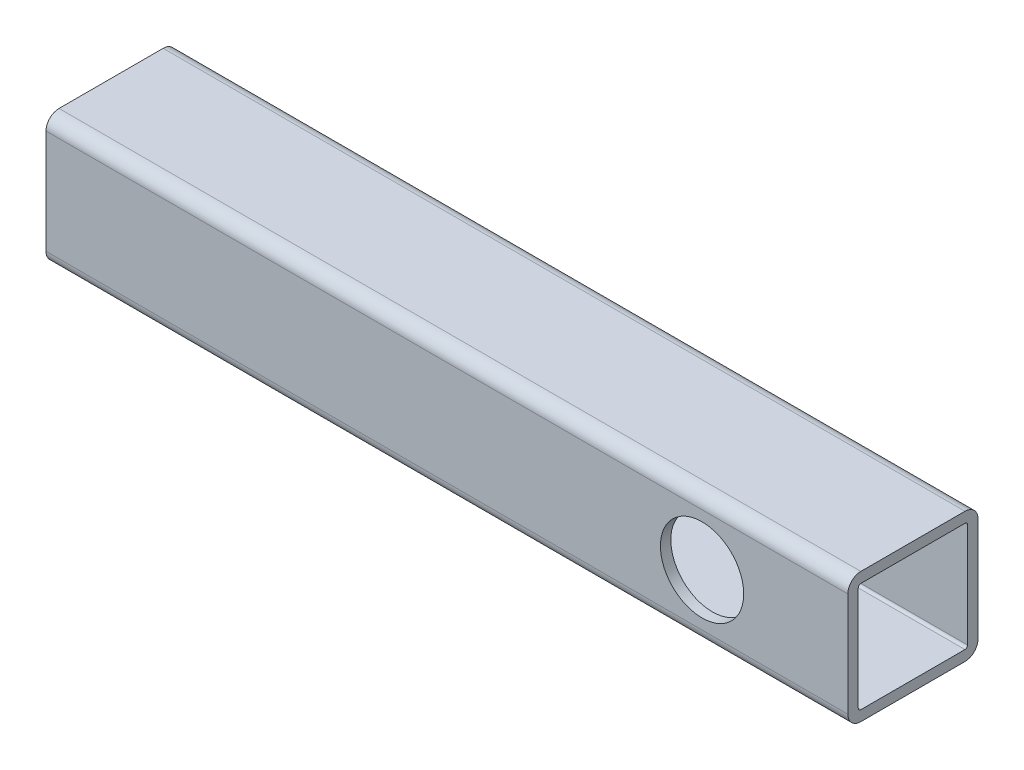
SolidWorks part; units mm, degrees
ref_plane "Plan de face" through (0, 0, 0) normal (0, 0, 1) x (1, 0, 0)
ref_plane "Plan de dessus" through (0, 0, 0) normal (0, 1, 0) x (1, 0, 0)
ref_plane "Plan de droite" through (0, 0, 0) normal (1, 0, 0) x (0, 0, -1)
sketch "Esquisse1" plane through (0, 0, 0) normal (1, 0, 0) x (0, 0, -1)
  line L0 (-10, 10.5) -> (10, 10.5)
  line L1 (-10, 12.5) -> (10, 12.5)
  line L2 (-12.5, 10) -> (-12.5, -10)
  line L3 (-10, -12.5) -> (10, -12.5)
  line L4 (12.5, 10) -> (12.5, -10)
  line L5 (-12.5, 12.5) -> (12.5, -12.5) construction
  line L6 (-12.5, -12.5) -> (12.5, 12.5) construction
  line L7 (10.5, 10) -> (10.5, -10)
  line L8 (-10, -10.5) -> (10, -10.5)
  line L9 (-10.5, 10) -> (-10.5, -10)
  arc A0 (-12.5, -10) -> (-10, -12.5) centre (-10, -10) ccw
  arc A1 (10, -12.5) -> (12.5, -10) centre (10, -10) ccw
  arc A2 (10, 12.5) -> (12.5, 10) centre (10, 10) cw
  arc A3 (-10, 12.5) -> (-12.5, 10) centre (-10, 10) ccw
  arc A4 (10, 10.5) -> (10.5, 10) centre (10, 10) cw
  arc A5 (10, -10.5) -> (10.5, -10) centre (10, -10) ccw
  arc A6 (-10.5, -10) -> (-10, -10.5) centre (-10, -10) ccw
  arc A7 (-10, 10.5) -> (-10.5, 10) centre (-10, 10) ccw
  point P0 (0, 0)
  dimension "D2" = 2.5
  dimension "D1" = 25
  dimension "D3" = 2
extrude "Boss.-Extru.1" add sketch "Esquisse1" along normal blind 154
sketch "Esquisse2" plane through (0, 0, 12.5) normal (0, 0, 1) x (1, 0, 0)
  line L0 (154, 10) -> (154, -10) construction
  circle A0 centre (126, 0) radius 8
  dimension "D1" = 16
  dimension "D2" = 28
extrude "Enlèv. mat.-Extru.1" cut sketch "Esquisse2" against normal through all
